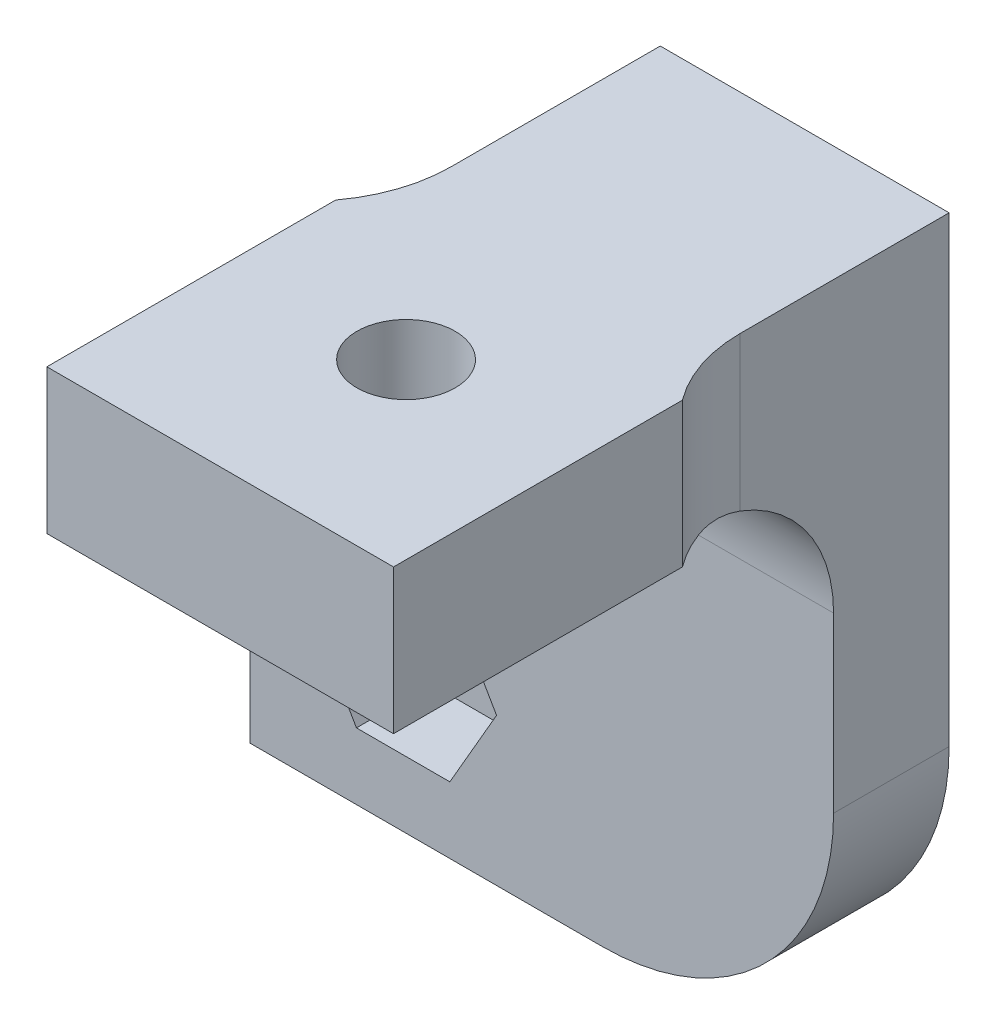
SolidWorks part; units mm, degrees
ref_plane "Front Plane" through (0, 0, 0) normal (0, 0, 1) x (1, 0, 0)
ref_plane "Top Plane" through (0, 0, 0) normal (0, 1, 0) x (1, 0, 0)
ref_plane "Right Plane" through (0, 0, 0) normal (1, 0, 0) x (0, 0, -1)
sketch "Sketch1" plane through (0, 0, 0) normal (0, 0, 1) x (1, 0, 0)
  line L1 (-11.4815, 6.2346) -> (-1.4815, 6.2346)
  line L2 (-11.4815, 6.2346) -> (-11.4815, -17.7654)
  line L3 (-11.4815, -17.7654) -> (-1.4815, -17.7654)
  line L4 (-1.4815, 6.2346) -> (-1.4815, -17.7654)
  dimension "D1" = 10
  dimension "D2" = 24
extrude "Boss-Extrude1" add sketch "Sketch1" along normal blind 4
ref_plane "Plane1" through (0, 0, 4) normal (0, 0, 1) x (1, 0, 0)
sketch "Sketch2" plane through (0, 0, 4) normal (0, 0, 1) x (1, 0, 0)
  line L0 (-11.4815, 6.2346) -> (-11.4815, -17.7654) construction
  line L1 (-11.4815, 1.2346) -> (-1.4815, 1.2346)
  line L2 (-11.4815, 1.2346) -> (-11.4815, 6.2346)
  line L3 (-11.4815, 6.2346) -> (-1.4815, 6.2346)
  line L4 (-1.4815, 1.2346) -> (-1.4815, 6.2346)
  dimension "D1" = 5
extrude "Boss-Extrude2" add sketch "Sketch2" along normal blind 15.4
ref_plane "Plane2" through (0, 1.2346, 0) normal (0, -1, 0) x (-1, 0, 0)
sketch "Sketch4" plane through (0, 1.2346, 0) normal (0, -1, 0) x (-1, 0, 0)
  line L1 (6.4815, -10.5668) -> (3.6815, -12.1834)
  line L2 (3.6815, -12.1834) -> (3.6815, -15.4166)
  line L3 (3.6815, -15.4166) -> (6.4815, -17.0332)
  line L4 (6.4815, -17.0332) -> (9.2815, -15.4166)
  line L5 (9.2815, -15.4166) -> (9.2815, -12.1834)
  line L6 (9.2815, -12.1834) -> (6.4815, -10.5668)
  circle A0 centre (6.4815, -13.8) radius 2.8 construction
  dimension "D1" = 5.6
extrude "Cut-Extrude1" cut sketch "Sketch4" against normal blind 2.6
sketch "Sketch5" plane through (0, 1.2346, 0) normal (0, -1, 0) x (-1, 0, 0)
  circle A0 centre (6.4815, -13.8) radius 1.7
extrude "Cut-Extrude2" cut sketch "Sketch5" against normal blind 8.6
fillet "Fillet1" radius 5 1 edges at (-6.4815, 1.2346, 4)
sketch "Sketch6" plane through (0, 0, 0) normal (0, 0, 1) x (1, 0, 0)
  line L1 (-11.4815, -17.7654) -> (-21.6815, -17.7654)
  line L2 (-11.4815, -17.7654) -> (-11.4815, -7.5654)
  line L3 (-11.4815, -7.5654) -> (-21.6815, -7.5654)
  line L4 (-21.6815, -17.7654) -> (-21.6815, -7.5654)
  circle A0 centre (-16.3815, -12.6654) radius 1.7
  dimension "D3" = 3.4
  dimension "D1" = 10.2
  dimension "D2" = 10.2
  dimension "D4" = 5.1
  dimension "D5" = 5.3
extrude "Boss-Extrude3" add sketch "Sketch6" along normal blind 4
sketch "Sketch7" plane through (0, 0, 4) normal (0, 0, 1) x (1, 0, 0)
  line L1 (-14.7649, -9.8654) -> (-17.9981, -9.8654)
  line L2 (-17.9981, -9.8654) -> (-19.6146, -12.6654)
  line L3 (-19.6146, -12.6654) -> (-17.9981, -15.4654)
  line L4 (-17.9981, -15.4654) -> (-14.7649, -15.4654)
  line L5 (-14.7649, -15.4654) -> (-13.1483, -12.6654)
  line L6 (-13.1483, -12.6654) -> (-14.7649, -9.8654)
  circle A0 centre (-16.3815, -12.6654) radius 2.8 construction
  dimension "D1" = 5.6
extrude "Cut-Extrude3" cut sketch "Sketch7" against normal blind 2.6
fillet "Fillet2" radius 4 2 edges at (-11.4815, -7.5654, 2) (-21.6815, -7.5654, 2)
fillet "Fillet3" radius 8 1 edges at (-1.4815, -17.7654, 2)
sketch "Sketch8" plane through (-96.5, 1.2346, 0) normal (0, -1, 0) x (-1, 0, 0)
  line L0 (-95.0185, -19.4) -> (-95.0185, -10.2332)
  line L1 (-95.0185, -19.4) -> (-95.0185, -9) construction
  line L2 (-95.0185, -10.2332) -> (-96.0185, -10.2332)
  line L3 (-96.0185, -10.2332) -> (-96.0185, -20.2332)
  line L4 (-96.0185, -20.2332) -> (-84.0185, -20.2332)
  line L5 (-84.0185, -20.2332) -> (-84.0185, -10.2332)
  line L6 (-84.0185, -10.2332) -> (-85.0185, -10.2332)
  line L7 (-85.0185, -19.4) -> (-85.0185, -9) construction
  line L8 (-85.0185, -10.2332) -> (-85.0185, -19.4)
  line L9 (-85.0185, -19.4) -> (-95.0185, -19.4)
  line L10 (-92.8185, -12.1834) -> (-92.8185, -15.4166) construction
  line L11 (-87.2185, -15.4166) -> (-87.2185, -12.1834) construction
  dimension "D1" = 3.2
  dimension "D2" = 3.2
  dimension "D3" = 3.2
  dimension "D4" = 10
  dimension "D5" = 10
extrude "Boss-Extrude4" add sketch "Sketch8" against normal blind 5
fillet "Fillet4" radius 5 2 edges at (-1.4815, 3.7346, 10.2332) (-11.4815, 3.7346, 10.2332)
